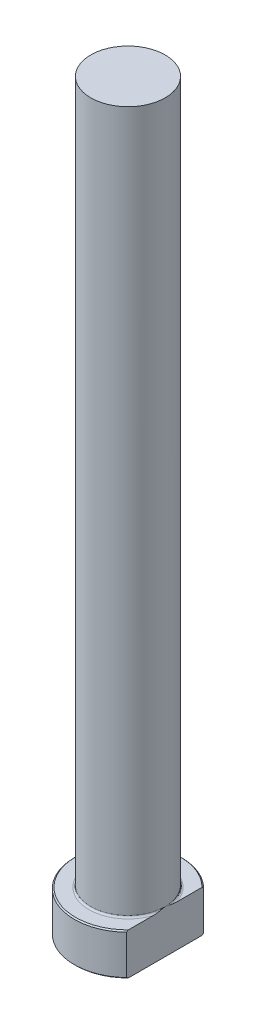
SolidWorks part; units mm, degrees
ref_plane "Front Plane" through (0, 0, 0) normal (0, 0, 1) x (1, 0, 0)
ref_plane "Top Plane" through (0, 0, 0) normal (0, 1, 0) x (1, 0, 0)
ref_plane "Right Plane" through (0, 0, 0) normal (1, 0, 0) x (0, 0, -1)
sketch "Sketch1" plane through (0, 0, 0) normal (0, 0, 1) x (1, 0, 0)
  line L0 (0, 259.9588) -> (0, -15.1925) construction
  line L1 (0, 0) -> (-9, 0)
  line L2 (-9, 0) -> (-9, 7)
  line L3 (-9, 7) -> (-6.25, 7)
  line L4 (-6.25, 7) -> (-6.25, 125)
  line L5 (-6.25, 125) -> (0, 125)
  line L6 (0, 125) -> (0, 0)
  dimension "L" = 125
  dimension "H" = 18
  dimension "T" = 7
  dimension "D" = 12.5
revolve "Revolve1" add sketch "Sketch1" angle 360 about L0
chamfer "Chamfer1" distance 0.2 angle 45 2 edges at (0, 7, 9) (0, 0, 9)
fillet "Fillet1" radius 0.3 1 edges at (0, 7, 6.25)
sketch "Sketch2" plane through (0, 0, 0) normal (0, 1, 0) x (1, 0, 0)
  line L0 (6.25, 6.4759) -> (6.25, -6.4759)
  circle A0 centre (0, 0) radius 9 construction
  arc A1 (6.25, -6.4759) -> (6.25, 6.4759) centre (0, 0) ccw
  circle A2 centre (0, 0) radius 6.25 construction
extrude "KEY" cut sketch "Sketch2" along normal through all
